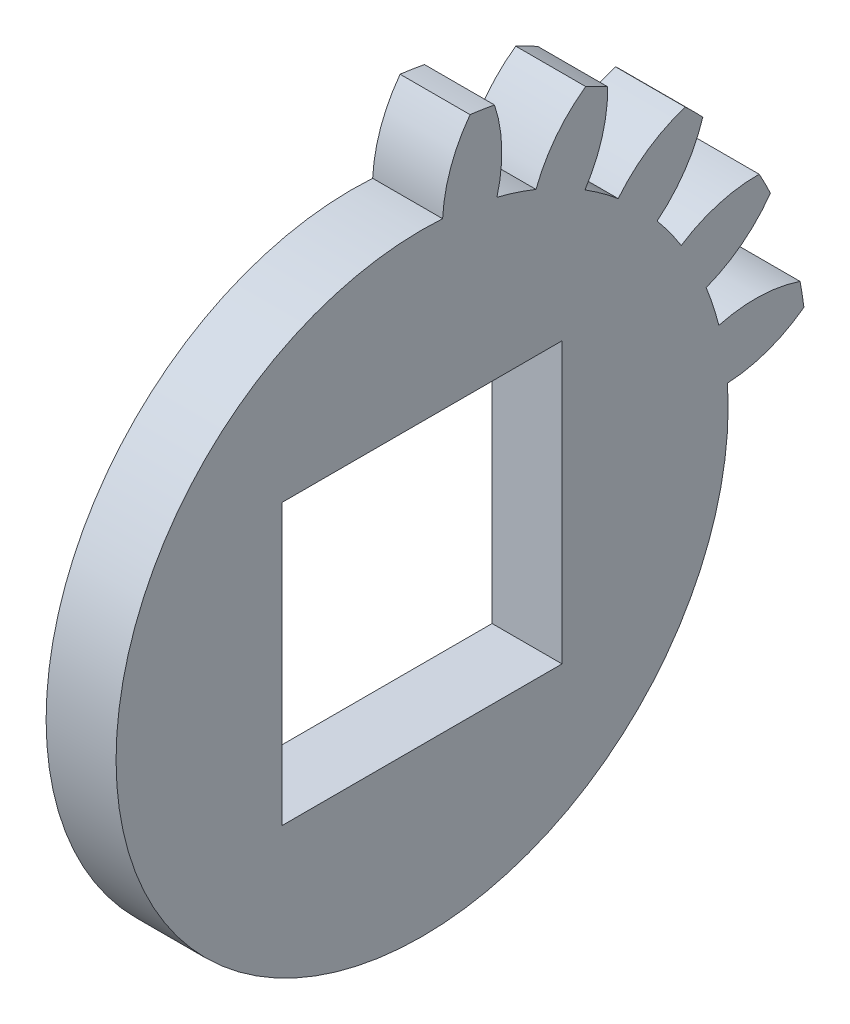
SolidWorks part; units mm, degrees
ref_plane "Plane1" through (0, 0, 0) normal (0, 0, 1) x (1, 0, 0)
ref_plane "Plane2" through (0, 0, 0) normal (0, 1, 0) x (1, 0, 0)
ref_plane "Plane3" through (0, 0, 0) normal (1, 0, 0) x (0, 0, -1)
sketch "HoldingSke" plane through (0, 0, 0) normal (0, 1, 0) x (1, 0, 0)
  line L0 (0, 0) -> (381.8911, -138.997)
  line L1 (-15, 0) -> (100, 0) construction
  line L2 (0, 0) -> (-2.1039, 2.3779)
  line L3 (0, 0) -> (-11.863, 4.5341)
  line L4 (0, 0) -> (8.1152, 2.9537)
  line L5 (0, 0) -> (-47.5972, -17.7524)
  line L6 (0, 0) -> (-2.632, -1.7758)
  line L7 (-2.1039, 2.3779) -> (8.8308, 51.9871)
  line L8 (-76.2, 54.61) -> (-72.771, 54.61)
  line L9 (-67.7845, 28.3722) -> (-49.3413, 33.142)
  line L10 (-76.2, 71.12) -> (104.1128, 71.12)
  line L11 (0, 0) -> (-3.175, 0)
  line L12 (-76.2, 101.6) -> (-76.1428, 101.6)
  line L13 (24.9733, 27.94) -> (52.9518, 28.4284)
  line L14 (24.9733, 27.94) -> (24.9746, 27.94)
  line L15 (24.9733, 27.94) -> (100.4006, 29.5858)
  circle A0 centre (0, 0) radius 1.5875
  circle A1 centre (0, 0) radius 13.8894
  circle A2 centre (0, 0) radius 38.1
  circle A3 centre (0, 0) radius 1.5875
  dimension "MHD" = 27.7787
  dimension "Hub_dia" = 76.2
  dimension "Bore" = 3.175
  dimension "MBD" = 3.175
  dimension "Num_teeth" = 20
  dimension "Pitch_radius" = 180.3128
  dimension "Pitch" = 406.4
  dimension "Width" = 3.175
  dimension "Overall_len" = 50.8
  dimension "Show_teeth" = 20
  dimension "Thickness" = 3.175
  dimension "OAL" = 50.8001
  dimension "T_dim" = 3.429
  dimension "Ap" = 14.5
  dimension "H" = 19.05
  dimension "Backlash" = 0.0571
  dimension "Addendum_fac" = 1
  dimension "Dedendum_fac" = 1.25
  dimension "Clearance_fac" = 0.25
  dimension "Dedendum_add" = 0.0013
sketch "BasProSke" plane through (0, 0, 0) normal (0, 1, 0) x (1, 0, 0)
  line L0 (-10, 0) -> (60, 0) construction
  line L1 (0, 0) -> (0, 17.4625)
  line L2 (0, 0) -> (3.175, 0)
  line L3 (3.175, 0) -> (3.175, 17.4625)
  line L4 (3.175, 17.4625) -> (0, 17.4625)
  dimension "Diameter" = 34.925
  dimension "Thickness" = 3.175
revolve "Base-Revolve" add sketch "BasProSke" angle 360 about L0
sketch "TooCutSke" plane through (0, 0, 0) normal (1, 0, 0) x (0, 0, -1)
  line L1 (0, 0) -> (0, 107) construction
  line L2 (0, 0) -> (-1.3455, 15.8179) construction
  line L3 (0, 0) -> (-4.9538, 31.2774) construction
  line L4 (-1.3455, 15.8179) -> (-2.4769, 15.6387) construction
  arc A0 (0.9308, 13.8581) -> (-0.9308, 13.8581) centre (0, 0) ccw
  arc A1 (2.1929, 17.3499) -> (-2.1929, 17.3499) centre (0, 0) ccw
  circle A2 centre (0, 0) radius 15.875 construction
  circle A3 centre (0, 0) radius 15.3693 construction
  arc A4 (-0.9308, 13.8581) -> (-2.1929, 17.3499) centre (-7.2728, 13.5397) ccw
  arc A5 (2.1929, 17.3499) -> (0.9308, 13.8581) centre (7.2728, 13.5397) ccw
  dimension "Root_dia" = 27.7787
  dimension "Overcut_dia" = 34.9758
  dimension "Pitch_dia" = 31.75
  dimension "Base_dia" = 30.7387
  dimension "Flank_rad" = 6.35
  dimension "Half_ang" = 9
  dimension "Half_CT" = 1.1455
extrude "ToothCut" cut sketch "TooCutSke" along normal through all
fillet "Breaks" [suppressed] radius 0.0318
fillet "RootFillets" [suppressed] radius 0.3981
pattern_circular "TeethCuts" count 20 every 18 about axis through (-10, 0, 0) along (1, 0, 0) of "ToothCut", "RootFillets", "Breaks"
sketch "HubNeaOneSke" plane through (0, 0, 0) normal (-1, 0, 0) x (0, 0, 1)
  circle A0 centre (0, 0) radius 13.8894
  dimension "Diameter" = 27.7787
extrude "HubNearOne" [suppressed] add sketch "HubNeaOneSke" along normal blind 47.6251
sketch "HubNeaBotSke" plane through (0, 0, 0) normal (-1, 0, 0) x (0, 0, 1)
  circle A0 centre (0, 0) radius 13.8894
  dimension "Diameter" = 27.7787
extrude "HubNearBoth" [suppressed] add sketch "HubNeaBotSke" along normal blind 23.8125
ref_plane "FarPln" through (3.175, 0, 0) normal (1, 0, 0) x (0, 0, -1)
sketch "HubFarSke" plane through (3.175, 0, 0) normal (1, 0, 0) x (0, 0, -1)
  circle A0 centre (0, 0) radius 13.8894
  dimension "Diameter" = 27.7787
extrude "HubFar" [suppressed] add sketch "HubFarSke" along normal blind 23.8125
sketch "BorSke" plane through (0, 0, 0) normal (1, 0, 0) x (0, 0, -1)
  circle A0 centre (0, 0) radius 1.5875
  dimension "Diameter" = 3.175
extrude "Bore" cut sketch "BorSke" along normal mid plane 101.6001
sketch "KeySke" plane through (0, 0, 0) normal (1, 0, 0) x (0, 0, -1)
  line L0 (-0.127, 0) -> (-0.127, 1.8415)
  line L1 (-0.127, 1.8415) -> (0.127, 1.8415)
  line L2 (0.127, 1.8415) -> (0.127, 0)
  line L3 (0, 0) -> (0, 34) construction
  line L4 (-0.127, 0) -> (0.127, 0)
  dimension "Offset" = 1.8415
  dimension "Width" = 0.254
extrude "Keyway" [suppressed] cut sketch "KeySke" along normal mid plane 101.6001
pattern_circular "Keyway2" [suppressed] count 2 every 90 about axis through (-10, 0, 0) along (1, 0, 0)
sketch "Sketch1" plane through (0, 0, 0) normal (1, 0, 0) x (0, 0, -1)
  line L0 (0, 17.4625) -> (0, 13.8894)
  line L1 (13.8894, 0) -> (17.4625, 0)
  arc A0 (0, 13.8894) -> (13.8894, 0) centre (0, 0) ccw
  arc A1 (0, 17.4625) -> (17.4625, 0) centre (0, 0) ccw
extrude "Cut-Extrude1" cut sketch "Sketch1" along normal blind 5.08
sketch "Sketch2" plane through (3.175, 0, 0) normal (1, 0, 0) x (0, 0, -1)
  line L1 (6.35, 6.35) -> (-6.35, 6.35)
  line L2 (6.35, 6.35) -> (6.35, -6.35)
  line L3 (6.35, -6.35) -> (-6.35, -6.35)
  line L4 (-6.35, 6.35) -> (-6.35, -6.35)
  line L5 (6.35, 6.35) -> (-6.35, -6.35) construction
  line L6 (6.35, -6.35) -> (-6.35, 6.35) construction
  point P0 (0, 0)
  dimension "D1" = 12.7
extrude "Cut-Extrude2" cut sketch "Sketch2" against normal blind 5.08
scale "Scale2" scale about centroid uniform scaling yes scale factor 0.5
equation "' \"Pitch@HoldingSke\" = 4"
equation "' \"Num_teeth@HoldingSke\" = 12"
equation "' \"Ap@HoldingSke\" =  20"
equation "' \"Width@HoldingSke\" = 0.5"
equation "' \"Hub_dia@HoldingSke\"= 1"
equation "' \"Overall_len@HoldingSke\" = 1.0"
equation "' \"Bore@HoldingSke\" = 0.75"
equation "' \"T_dim@HoldingSke\" = 0.85"
equation "' \"Width@KeySke\" = 0.25"
equation "' \"Show_teeth@HoldingSke\" = 13"
equation "' \"Backlash@HoldingSke\" = 0.009"
equation "' \"Addendum_fac@HoldingSke\" = 1.0"
equation "' \"Dedendum_fac@HoldingSke\" = 1.25"
equation "' \"Dedendum_add@HoldingSke\" = 0.00005"
equation "' \"Clearance_fac@HoldingSke\" = 0.25"
equation "' \"Pitch@HoldingSke\" = 0.5"
equation "' \"Num_teeth@HoldingSke\" = 23"
equation "' \"Show_teeth@HoldingSke\" = 23"
equation "' \"Backlash@HoldingSke\" = 0.0375"
equation "\"Overcut_dia@TooCutSke\" = (\"Num_teeth@HoldingSke\" + 2 * \"Addendum_fac@HoldingSke\") / \"Pitch@HoldingSke\" + 0.002"
equation "\"Pitch_dia@TooCutSke\" = \"Num_teeth@HoldingSke\" / \"Pitch@HoldingSke\""
equation "\"Base_dia@TooCutSke\" = \"Num_teeth@HoldingSke\" / \"Pitch@HoldingSke\" * cos((\"Ap@HoldingSke\"  * 3.14159265 / 180))"
equation "\"Root_dia@TooCutSke\" = (\"Num_teeth@HoldingSke\" + 2) / \"Pitch@HoldingSke\" - 2 * (\"Addendum_fac@HoldingSke\" + \"Dedendum_fac@HoldingSke\") / \"Pitch@HoldingSke\" - \"Dedendum_add@HoldingSke\" * 2"
equation "\"Half_ang@TooCutSke\" = 180 / \"Num_teeth@HoldingSke\""
equation "\"Half_CT@TooCutSke\" = \"Num_teeth@HoldingSke\" / \"Pitch@HoldingSke\" * sin((3.14159265 / 2 / \"Num_teeth@HoldingSke\")) / 2 - 7 * \"Backlash@HoldingSke\" / 4"
equation "\"Flank_rad@TooCutSke\" = \"Num_teeth@HoldingSke\" / \"Pitch@HoldingSke\" / 5"
equation "\"Radius@RootFillets\" = \"Clearance_fac@HoldingSke\" / \"Pitch@HoldingSke\" + \"Dedendum_add@HoldingSke\""
equation "\"Break_rad@Breaks\" = 0.02 / \"Pitch@HoldingSke\""
equation "\"Thickness@HoldingSke\" = \"Width@HoldingSke\""
equation "\"OAL@HoldingSke\" = \"Thickness@HoldingSke\""
equation "\"MHD@HoldingSke\" = (\"Num_teeth@HoldingSke\" + 2) / \"Pitch@HoldingSke\" - 2 * (\"Addendum_fac@HoldingSke\" + \"Dedendum_fac@HoldingSke\")  / \"Pitch@HoldingSke\" - \"Dedendum_add@HoldingSke\" * 2"
equation "\"MBD@HoldingSke\" = (\"Num_teeth@HoldingSke\" + 2) / \"Pitch@HoldingSke\" - 2 * (\"Addendum_fac@HoldingSke\" + \"Dedendum_fac@HoldingSke\")  / \"Pitch@HoldingSke\" - \"Dedendum_add@HoldingSke\" * 2 - 0.002"
equation "\"MHD@HoldingSke\" = ((sgn( \"MHD@HoldingSke\" - \"Hub_dia@HoldingSke\" )-1)*( \"MHD@HoldingSke\" - \"Hub_dia@HoldingSke\" ))/-2+ \"Hub_dia@HoldingSke\""
equation "\"MBD@HoldingSke\" = ((sgn( \"MBD@HoldingSke\" - \"Bore@HoldingSke\" )-1)*( \"MBD@HoldingSke\" - \"Bore@HoldingSke\" ))/-2+ \"Bore@HoldingSke\""
equation "\"OAL@HoldingSke\" = ((sgn( \"OAL@HoldingSke\" - \"Overall_len@HoldingSke\" )+1)*( \"OAL@HoldingSke\" - \"Overall_len@HoldingSke\" ))/2 + \"Overall_len@HoldingSke\" + 0.000002"
equation "\"Num_teeth@TeethCuts\" = int( \"Show_teeth@HoldingSke\" ) + 1"
equation "\"Num_teeth@TeethCuts\" = ((sgn( \"Num_teeth@TeethCuts\" - \"Num_teeth@HoldingSke\" )-1)*( \"Num_teeth@TeethCuts\" - \"Num_teeth@HoldingSke\" ))/-2+ \"Num_teeth@HoldingSke\""
equation "\"Num_teeth@TeethCuts\" = ((sgn( \"Num_teeth@TeethCuts\" - 2.0)+1)*( \"Num_teeth@TeethCuts\" - 2.0))/2 +2.0"
equation "\"Angle@TeethCuts\" = 360.0 / \"Num_teeth@HoldingSke\""
equation "\"Diameter@BasProSke\" = (\"Num_teeth@HoldingSke\" + 2 * \"Addendum_fac@HoldingSke\") / \"Pitch@HoldingSke\""
equation "\"Thickness@BasProSke\"  = \"Thickness@HoldingSke\""
equation "' \"Fillet_rad@BasProSke\" =  \"Thickness@HoldingSke\" * 0.05"
equation "\"MHD@HoldingSke\" = ((sgn( \"MHD@HoldingSke\" - \"Root_dia@TooCutSke\" )-1)*( \"MHD@HoldingSke\" - \"Root_dia@TooCutSke\" ))/-2+ \"Root_dia@TooCutSke\""
equation "\"Diameter@HubNeaOneSke\" = \"MHD@HoldingSke\""
equation "\"Length@HubNearOne\" = \"OAL@HoldingSke\" - \"Thickness@BasProSke\""
equation "\"Diameter@HubNeaBotSke\" = \"MHD@HoldingSke\""
equation "\"Length@HubNearBoth\" = ( \"OAL@HoldingSke\" - \"Thickness@BasProSke\" ) / 2.0"
equation "\"Thickness@FarPln\" = \"Thickness@BasProSke\""
equation "\"Diameter@HubFarSke\" = \"MHD@HoldingSke\""
equation "\"Length@HubFar\" = ( \"OAL@HoldingSke\" - \"Thickness@BasProSke\" ) / 2.0"
equation "\"Diameter@BorSke\" = \"MBD@HoldingSke\""
equation "\"D1@Bore\" = \"OAL@HoldingSke\" * 2.0"
equation "\"D1@Keyway\" = \"OAL@HoldingSke\" * 2.0"
equation "\"Offset@KeySke\" = \"T_dim@HoldingSke\" - \"MBD@HoldingSke\" / 2.0"
